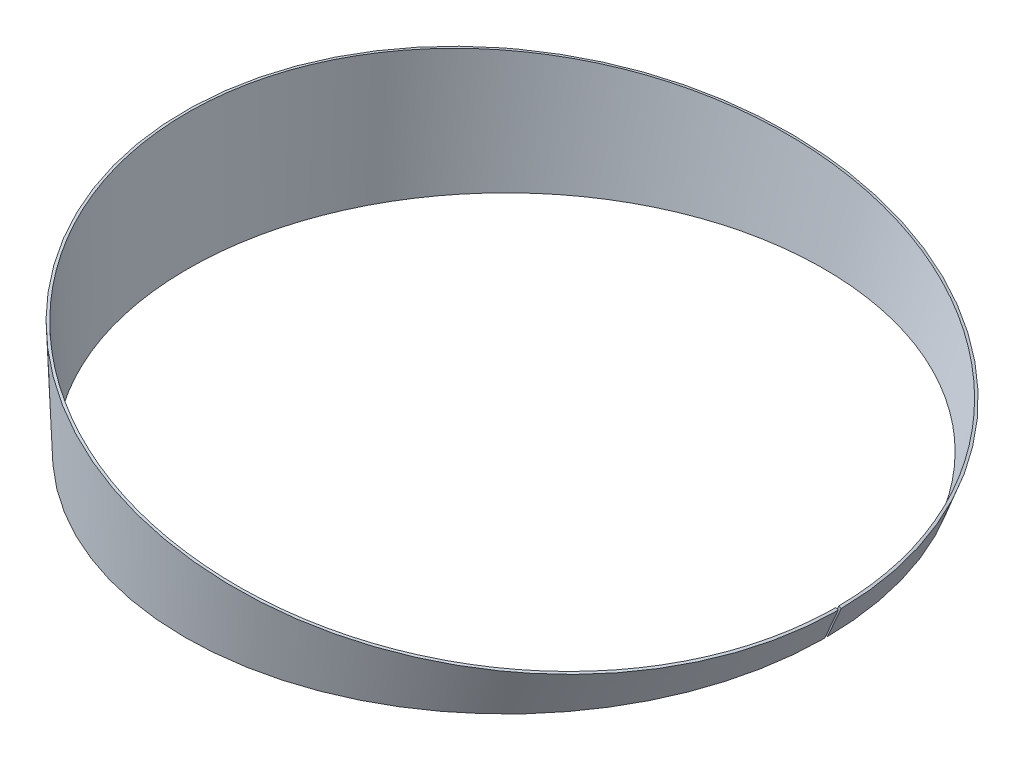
SolidWorks part; units mm, degrees
ref_plane "Ebene vorne" through (0, 0, 0) normal (0, 0, 1) x (1, 0, 0)
ref_plane "Ebene oben" through (0, 0, 0) normal (0, 1, 0) x (1, 0, 0)
ref_plane "Ebene rechts" through (0, 0, 0) normal (1, 0, 0) x (0, 0, -1)
sketch "Skizze1" plane through (0, 0, 0) normal (0, 0, 1) x (1, 0, 0)
  line L0 (0, 0) -> (40, 0) construction
  line L1 (40, 0) -> (0.4925, 6.2574) construction
  arc A0 (0.4925, 6.2574) -> (0, 0) centre (40, 0) ccw
  dimension "D1" = 9
  dimension "D2" = 40
ref_plane "Ebene1" through (0.4925, 6.2574, 0) normal (-0.1564, -0.9877, 0) x (0.9877, -0.1564, 0)
sketch "Skizze2" plane through (0, 0, 0) normal (0, 1, 0) x (1, 0, 0)
  line L0 (24.1563, 0.1054) -> (0, 0) construction
  line L1 (0, 0) -> (24.1563, -0.1054) construction
  line L2 (24.1563, -0.1054) -> (24.1563, 0.1054) construction
  arc A0 (24.1563, 0.1054) -> (24.1563, -0.1054) centre (0, 0) ccw
  dimension "D1" = 48.313
  dimension "D2" = 0.5
sketch "Skizze3" plane through (0.4925, 6.2574, 0) normal (-0.1564, -0.9877, 0) x (0.9877, -0.1564, 0)
  line L0 (24.9998, -0.1091) -> (0, 0) construction
  line L1 (0, 0) -> (24.9998, 0.1091) construction
  line L2 (24.9998, 0.1091) -> (24.9998, -0.1091) construction
  arc A0 (24.9998, 0.1091) -> (24.9998, -0.1091) centre (0, 0) ccw
  dimension "D1" = 50
  dimension "D2" = 0.5
sheet metal parameters "Blech1" thickness 0.2 parameters "D1"=2, "Dicke"=0.2
lofted bend "Ausgeformte Biegungen1" parameters "D1"=0, "D12"=0.2
other "Freiform-Biegung1" parameters "D1"=1000, "D4"=57.296, "D5"=1
flat pattern "Abwicklung1"
sketch "Biegung-Linien1" plane through (0, 0, 0) normal (0, 1, 0) x (-1, 0, 0)
other "Abwickeln-<Freiform-Biegung1>1"
